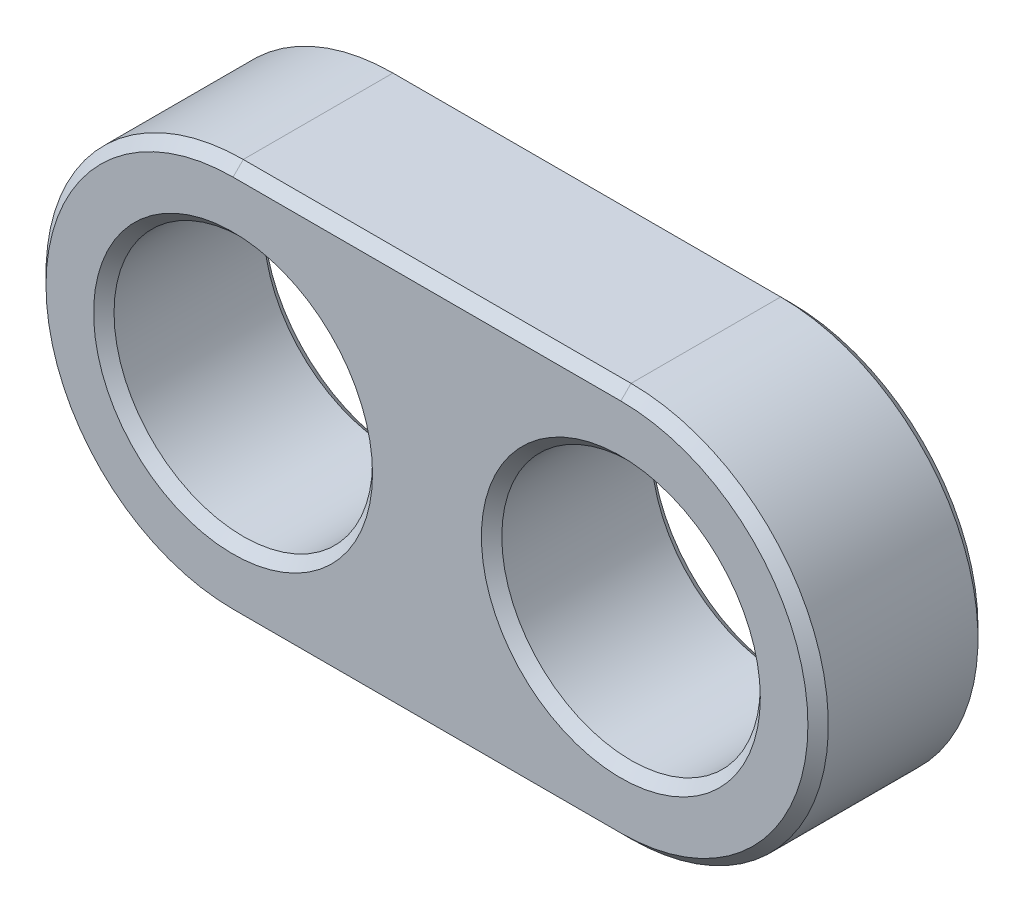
SolidWorks part; units mm, degrees
ref_plane "Plan1" through (0, 0, 0) normal (0, 0, 1) x (1, 0, 0)
ref_plane "Plan2" through (0, 0, 0) normal (0, 1, 0) x (1, 0, 0)
ref_plane "Plan3" through (0, 0, 0) normal (1, 0, 0) x (0, 0, -1)
sketch "Esquisse1" plane through (0, 0, 0) normal (0, 0, 1) x (1, 0, 0)
  line L0 (0, 0) -> (95.8975, 0) construction
  line L1 (0, 29) -> (57, 29)
  line L2 (57, -29) -> (0, -29)
  arc A0 (0, 29) -> (0, -29) centre (0, 0) ccw
  circle A1 centre (0, 0) radius 19
  arc A2 (57, -29) -> (57, 29) centre (57, 0) ccw
  circle A3 centre (57, 0) radius 19
  dimension "D1" = 58
  dimension "D2" = 38
  dimension "D3" = 57
  dimension "D4" = 38
extrude "Extrusion1" add sketch "Esquisse1" along normal mid plane 25
ref_plane "Plan4" through (0, 0, 0) normal (0, 0, 1) x (1, 0, 0)
chamfer "Chanfrein1" distance 1.5 angle 45 12 edges at (76, 0, -12.5) (19, 0, -12.5) (76, 0, 12.5) (19, 0, 12.5) (-29, 0, -12.5) (28.5, -29, -12.5) (86, 0, -12.5) (28.5, 29, -12.5) (86, 0, 12.5) (28.5, -29, 12.5) (-29, 0, 12.5) (28.5, 29, 12.5)
